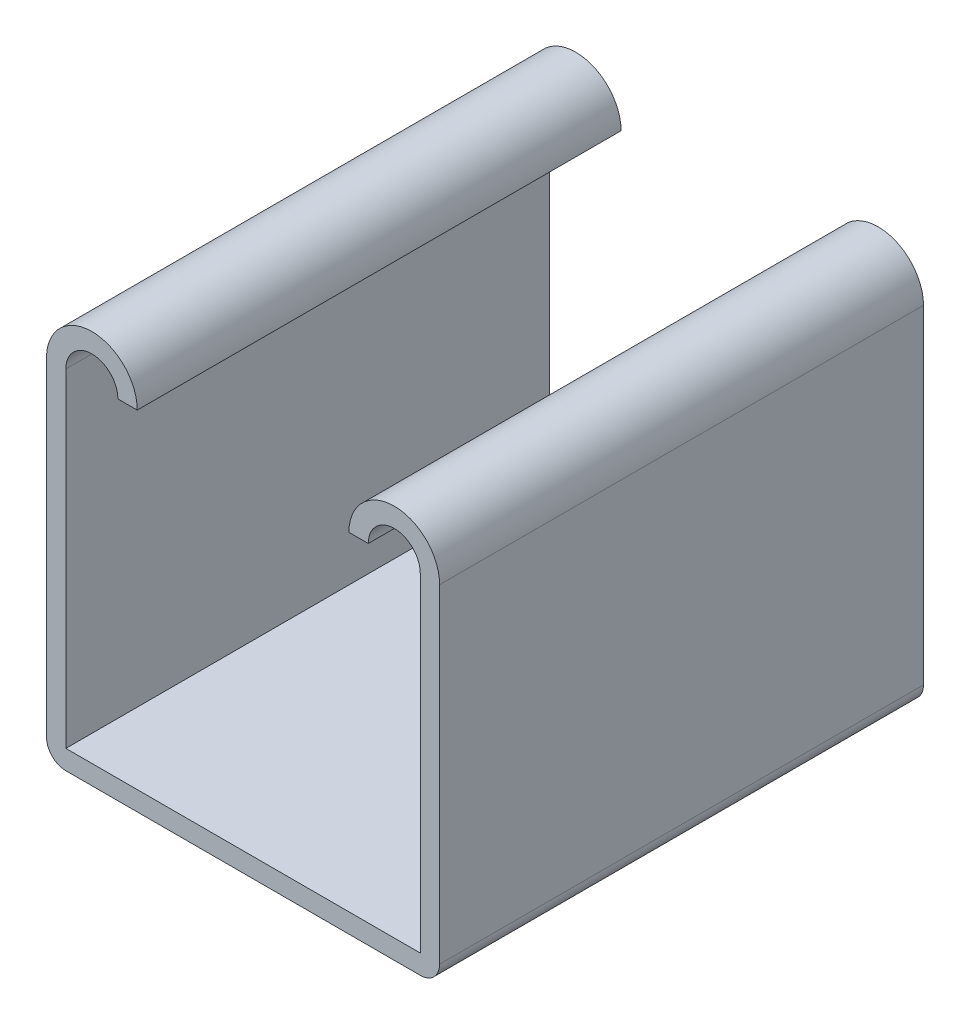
SolidWorks part; units mm, degrees
ref_plane "Plane1" through (0, 0, 0) normal (0, 0, 1) x (1, 0, 0)
ref_plane "Plane2" through (0, 0, 0) normal (0, 1, 0) x (1, 0, 0)
ref_plane "Plane3" through (0, 0, 0) normal (1, 0, 0) x (0, 0, -1)
sketch "Sketch1" plane through (0, 0, 0) normal (0, 0, 1) x (1, 0, 0)
  line L0 (-10.3188, 9.3789) -> (-10.3187, -7.874)
  line L1 (-9.3027, -8.89) -> (9.3028, -8.89)
  line L2 (10.3187, -7.874) -> (10.3187, 9.3789)
  line L3 (-6.5723, 9.3789) -> (-5.5562, 9.3789)
  line L4 (5.5562, 9.3789) -> (6.5722, 9.3789)
  line L6 (-9.3027, 9.3789) -> (-9.3027, -7.874)
  line L7 (-9.3027, -7.874) -> (9.3028, -7.874)
  line L8 (9.3028, -7.874) -> (9.3028, 9.3789)
  line L10 (-25.4, 11.7602) -> (25.4, 11.7602) construction
  arc A0 (10.3187, 9.3789) -> (5.5562, 9.3789) centre (7.9375, 9.3789) ccw
  arc A1 (-10.3188, 9.3789) -> (-5.5562, 9.3789) centre (-7.9375, 9.3789) cw
  arc A2 (-9.3027, -8.89) -> (-10.3187, -7.874) centre (-9.3027, -7.874) cw
  arc A3 (9.3028, -8.89) -> (10.3187, -7.874) centre (9.3028, -7.874) ccw
  arc A4 (-9.3027, 9.3789) -> (-6.5723, 9.3789) centre (-7.9375, 9.3789) cw
  arc A5 (9.3028, 9.3789) -> (6.5722, 9.3789) centre (7.9375, 9.3789) ccw
  dimension "D1" = 1.016
  dimension "D3" = 10.3187
  dimension "D4" = 11.1125
  dimension "Width" = 20.6375
  dimension "D5" = 8.89
  dimension "D6" = 4.7625
  dimension "D7" = 1.016
  dimension "D8" = 11.7602
  dimension "D2" = 2.3812
  dimension "gauge" = 1.016
extrude "Base-Extrude" add sketch "Sketch1" along normal mid plane 25.4
equation "\"D3@Sketch1\" = \"Width@Sketch1\" / 2"
equation "\"D1@Sketch1\" = \"gauge@Sketch1\""
